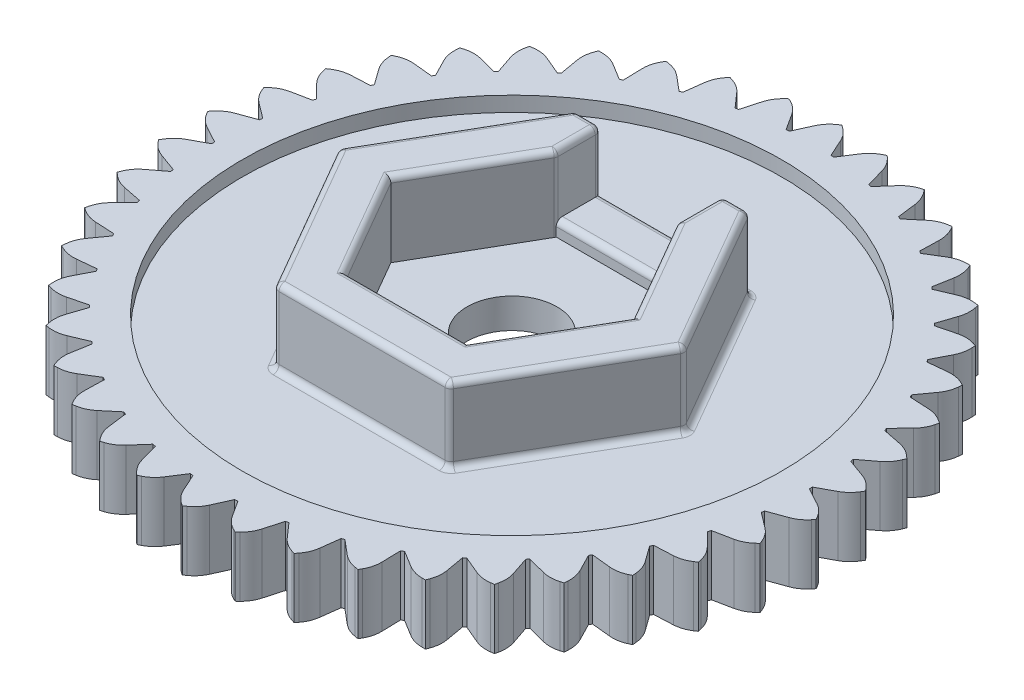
SolidWorks part; units mm, degrees
ref_plane "Front Plane" through (0, 0, 0) normal (0, 0, 1) x (1, 0, 0)
ref_plane "Top Plane" through (0, 0, 0) normal (0, 1, 0) x (1, 0, 0)
ref_plane "Right Plane" through (0, 0, 0) normal (1, 0, 0) x (0, 0, -1)
sketch "Sketch1" plane through (0, 0, 0) normal (0, 1, 0) x (1, 0, 0)
  circle A0 centre (0, 0) radius 11
  dimension "D1" = 22
extrude "Boss-Extrude1" add sketch "Sketch1" along normal blind 2
sketch "Sketch2" plane through (0, 2, 0) normal (0, 1, 0) x (1, 0, 0)
  line L0 (0, 0) -> (0, 11) construction
  line L1 (0, 0) -> (1.6395, 10.8771) construction
  line L2 (0, 0) -> (3.2423, 10.5113) construction
  line L3 (0, 0) -> (4.7727, 9.9107) construction
  line L4 (0, 0) -> (6.1965, 9.0886) construction
  line L5 (0, 0) -> (7.4819, 8.0636) construction
  line L6 (0, 0) -> (8.6001, 6.8584) construction
  line L7 (0, 0) -> (9.5263, 5.5) construction
  line L8 (0, 0) -> (10.2396, 4.0188) construction
  line L9 (0, 0) -> (10.7242, 2.4477) construction
  line L10 (0, 0) -> (10.9692, 0.822) construction
  line L11 (0, 0) -> (10.9692, -0.822) construction
  line L12 (0, 0) -> (10.7242, -2.4477) construction
  line L13 (0, 0) -> (10.2396, -4.0188) construction
  line L14 (0, 0) -> (9.5263, -5.5) construction
  line L15 (0, 0) -> (8.6001, -6.8584) construction
  line L16 (0, 0) -> (7.4819, -8.0636) construction
  line L17 (0, 0) -> (6.1965, -9.0886) construction
  line L18 (0, 0) -> (4.7727, -9.9107) construction
  line L19 (0, 0) -> (3.2423, -10.5113) construction
  line L20 (0, 0) -> (1.6395, -10.8771) construction
  line L21 (0, 0) -> (0, -11) construction
  line L22 (0, 0) -> (-1.6395, -10.8771) construction
  line L23 (0, 0) -> (-3.2423, -10.5113) construction
  line L24 (0, 0) -> (-4.7727, -9.9107) construction
  line L25 (0, 0) -> (-6.1965, -9.0886) construction
  line L26 (0, 0) -> (-7.4819, -8.0636) construction
  line L27 (0, 0) -> (-8.6001, -6.8584) construction
  line L28 (0, 0) -> (-9.5263, -5.5) construction
  line L29 (0, 0) -> (-10.2396, -4.0188) construction
  line L30 (0, 0) -> (-10.7242, -2.4477) construction
  line L31 (0, 0) -> (-10.9692, -0.822) construction
  line L32 (0, 0) -> (-10.9692, 0.822) construction
  line L33 (0, 0) -> (-10.7242, 2.4477) construction
  line L34 (0, 0) -> (-10.2396, 4.0188) construction
  line L35 (0, 0) -> (-9.5263, 5.5) construction
  line L36 (0, 0) -> (-8.6001, 6.8584) construction
  line L37 (0, 0) -> (-7.4819, 8.0636) construction
  line L38 (0, 0) -> (-6.1965, 9.0886) construction
  line L39 (0, 0) -> (-4.7727, 9.9107) construction
  line L40 (0, 0) -> (-3.2423, 10.5113) construction
  line L41 (0, 0) -> (-1.6395, 10.8771) construction
  line L42 (0, 11) -> (1.6395, 10.8771) construction
  line L43 (0.8197, 10.9386) -> (0.745, 9.9414) construction
  line L44 (0.7949, 9.9376) -> (0.6951, 9.9451)
  line L45 (0.6951, 9.9451) -> (0.4343, 10.5244)
  line L46 (0.0948, 10.9339) -> (0, 11)
  line L47 (0.7949, 9.9376) -> (1.1391, 10.4716)
  line L48 (1.5359, 10.8259) -> (1.6395, 10.8771)
  line L49 (1.7233, 10.7976) -> (1.6395, 10.8771)
  line L50 (2.1696, 9.7304) -> (1.998, 10.3421)
  line L51 (2.2671, 9.7082) -> (2.1696, 9.7304)
  line L52 (2.2671, 9.7082) -> (2.6871, 10.1848)
  line L53 (3.1322, 10.476) -> (3.2423, 10.5113)
  line L54 (3.3134, 10.4202) -> (3.2423, 10.5113)
  line L55 (3.5956, 9.2984) -> (3.5171, 9.9288)
  line L56 (3.6887, 9.2618) -> (3.5956, 9.2984)
  line L57 (3.6887, 9.2618) -> (4.1751, 9.6706)
  line L58 (4.6586, 9.8922) -> (4.7727, 9.9107)
  line L59 (4.8294, 9.8099) -> (4.7727, 9.9107)
  line L60 (4.9413, 8.6586) -> (4.9576, 9.2937)
  line L61 (5.0279, 8.6086) -> (4.9413, 8.6586)
  line L62 (5.0279, 8.6086) -> (5.5698, 8.9403)
  line L63 (6.081, 9.0874) -> (6.1965, 9.0886)
  line L64 (6.2376, 8.9806) -> (6.1965, 9.0886)
  line L65 (6.1766, 7.8254) -> (6.2874, 8.451)
  line L66 (6.2548, 7.7631) -> (6.1766, 7.8254)
  line L67 (6.2548, 7.7631) -> (6.8401, 8.0103)
  line L68 (7.3674, 8.0795) -> (7.4819, 8.0636)
  line L69 (7.5064, 7.9506) -> (7.4819, 8.0636)
  line L70 (7.274, 6.8175) -> (7.4768, 7.4195)
  line L71 (7.342, 6.7442) -> (7.274, 6.8175)
  line L72 (7.342, 6.7442) -> (7.9575, 6.9014)
  line L73 (8.4893, 6.8912) -> (8.6001, 6.8584)
  line L74 (8.6075, 6.7431) -> (8.6001, 6.8584)
  line L75 (8.2088, 5.6572) -> (8.4991, 6.2223)
  line L76 (8.2651, 5.5746) -> (8.2088, 5.6572)
  line L77 (8.2651, 5.5746) -> (8.8973, 5.6383)
  line L78 (9.4216, 5.549) -> (9.5263, 5.5)
  line L79 (9.5164, 5.3849) -> (9.5263, 5.5)
  line L80 (8.9603, 4.3705) -> (9.3315, 4.8861)
  line L81 (9.0037, 4.2804) -> (8.9603, 4.3705)
  line L82 (9.0037, 4.2804) -> (9.6382, 4.2493)
  line L83 (10.1434, 4.0828) -> (10.2396, 4.0188)
  line L84 (10.2127, 3.9064) -> (10.2396, 4.0188)
  line L85 (9.5116, 2.9863) -> (9.9556, 3.4407)
  line L86 (9.5411, 2.8907) -> (9.5116, 2.9863)
  line L87 (9.5411, 2.8907) -> (10.1639, 2.7653)
  line L88 (10.6386, 2.5254) -> (10.7242, 2.4477)
  line L89 (10.6808, 2.3406) -> (10.7242, 2.4477)
  line L90 (9.8504, 1.5353) -> (10.3572, 1.9185)
  line L91 (9.8653, 1.4364) -> (9.8504, 1.5353)
  line L92 (9.8653, 1.4364) -> (10.4625, 1.2196)
  line L93 (10.8962, 0.9116) -> (10.9692, 0.822)
  line L94 (10.9104, 0.7226) -> (10.9692, 0.822)
  line L95 (9.9692, 0.05) -> (10.5274, 0.3534)
  line L96 (9.9692, -0.05) -> (9.9692, 0.05)
  line L97 (9.9692, -0.05) -> (10.5274, -0.3534)
  line L98 (10.9104, -0.7226) -> (10.9692, -0.822)
  line L99 (10.8962, -0.9116) -> (10.9692, -0.822)
  line L100 (9.8653, -1.4364) -> (10.4625, -1.2196)
  line L101 (9.8504, -1.5353) -> (9.8653, -1.4364)
  line L102 (9.8504, -1.5353) -> (10.3572, -1.9185)
  line L103 (10.6808, -2.3406) -> (10.7242, -2.4477)
  line L104 (10.6386, -2.5254) -> (10.7242, -2.4477)
  line L105 (9.5411, -2.8907) -> (10.1639, -2.7653)
  line L106 (9.5116, -2.9863) -> (9.5411, -2.8907)
  line L107 (9.5116, -2.9863) -> (9.9556, -3.4407)
  line L108 (10.2127, -3.9064) -> (10.2396, -4.0188)
  line L109 (10.1434, -4.0828) -> (10.2396, -4.0188)
  line L110 (9.0037, -4.2804) -> (9.6382, -4.2493)
  line L111 (8.9603, -4.3705) -> (9.0037, -4.2804)
  line L112 (8.9603, -4.3705) -> (9.3315, -4.8861)
  line L113 (9.5164, -5.3849) -> (9.5263, -5.5)
  line L114 (9.4216, -5.549) -> (9.5263, -5.5)
  line L115 (8.2651, -5.5746) -> (8.8973, -5.6383)
  line L116 (8.2088, -5.6572) -> (8.2651, -5.5746)
  line L117 (8.2088, -5.6572) -> (8.4991, -6.2223)
  line L118 (8.6075, -6.7431) -> (8.6001, -6.8584)
  line L119 (8.4893, -6.8912) -> (8.6001, -6.8584)
  line L120 (7.342, -6.7442) -> (7.9575, -6.9014)
  line L121 (7.274, -6.8175) -> (7.342, -6.7442)
  line L122 (7.274, -6.8175) -> (7.4768, -7.4195)
  line L123 (7.5064, -7.9506) -> (7.4819, -8.0636)
  line L124 (7.3674, -8.0795) -> (7.4819, -8.0636)
  line L125 (6.2548, -7.7631) -> (6.8401, -8.0103)
  line L126 (6.1766, -7.8254) -> (6.2548, -7.7631)
  line L127 (6.1766, -7.8254) -> (6.2874, -8.451)
  line L128 (6.2376, -8.9806) -> (6.1965, -9.0886)
  line L129 (6.081, -9.0874) -> (6.1965, -9.0886)
  line L130 (5.0279, -8.6086) -> (5.5698, -8.9403)
  line L131 (4.9413, -8.6586) -> (5.0279, -8.6086)
  line L132 (4.9413, -8.6586) -> (4.9576, -9.2937)
  line L133 (4.8294, -9.8099) -> (4.7727, -9.9107)
  line L134 (4.6586, -9.8922) -> (4.7727, -9.9107)
  line L135 (3.6887, -9.2618) -> (4.1751, -9.6706)
  line L136 (3.5956, -9.2984) -> (3.6887, -9.2618)
  line L137 (3.5956, -9.2984) -> (3.5171, -9.9288)
  line L138 (3.3134, -10.4202) -> (3.2423, -10.5113)
  line L139 (3.1322, -10.476) -> (3.2423, -10.5113)
  line L140 (2.2671, -9.7082) -> (2.6871, -10.1848)
  line L141 (2.1696, -9.7304) -> (2.2671, -9.7082)
  line L142 (2.1696, -9.7304) -> (1.998, -10.3421)
  line L143 (1.7233, -10.7976) -> (1.6395, -10.8771)
  line L144 (1.5359, -10.8259) -> (1.6395, -10.8771)
  line L145 (0.7949, -9.9376) -> (1.1391, -10.4716)
  line L146 (0.6951, -9.9451) -> (0.7949, -9.9376)
  line L147 (0.6951, -9.9451) -> (0.4343, -10.5244)
  line L148 (0.0948, -10.9339) -> (0, -11)
  line L149 (-0.0948, -10.9339) -> (0, -11)
  line L150 (-0.6951, -9.9451) -> (-0.4343, -10.5244)
  line L151 (-0.7949, -9.9376) -> (-0.6951, -9.9451)
  line L152 (-0.7949, -9.9376) -> (-1.1391, -10.4716)
  line L153 (-1.5359, -10.8259) -> (-1.6395, -10.8771)
  line L154 (-1.7233, -10.7976) -> (-1.6395, -10.8771)
  line L155 (-2.1696, -9.7304) -> (-1.998, -10.3421)
  line L156 (-2.2671, -9.7082) -> (-2.1696, -9.7304)
  line L157 (-2.2671, -9.7082) -> (-2.6871, -10.1848)
  line L158 (-3.1322, -10.476) -> (-3.2423, -10.5113)
  line L159 (-3.3134, -10.4202) -> (-3.2423, -10.5113)
  line L160 (-3.5956, -9.2984) -> (-3.5171, -9.9288)
  line L161 (-3.6887, -9.2618) -> (-3.5956, -9.2984)
  line L162 (-3.6887, -9.2618) -> (-4.1751, -9.6706)
  line L163 (-4.6586, -9.8922) -> (-4.7727, -9.9107)
  line L164 (-4.8294, -9.8099) -> (-4.7727, -9.9107)
  line L165 (-4.9413, -8.6586) -> (-4.9576, -9.2937)
  line L166 (-5.0279, -8.6086) -> (-4.9413, -8.6586)
  line L167 (-5.0279, -8.6086) -> (-5.5698, -8.9403)
  line L168 (-6.081, -9.0874) -> (-6.1965, -9.0886)
  line L169 (-6.2376, -8.9806) -> (-6.1965, -9.0886)
  line L170 (-6.1766, -7.8254) -> (-6.2874, -8.451)
  line L171 (-6.2548, -7.7631) -> (-6.1766, -7.8254)
  line L172 (-6.2548, -7.7631) -> (-6.8401, -8.0103)
  line L173 (-7.3674, -8.0795) -> (-7.4819, -8.0636)
  line L174 (-7.5064, -7.9506) -> (-7.4819, -8.0636)
  line L175 (-7.274, -6.8175) -> (-7.4768, -7.4195)
  line L176 (-7.342, -6.7442) -> (-7.274, -6.8175)
  line L177 (-7.342, -6.7442) -> (-7.9575, -6.9014)
  line L178 (-8.4893, -6.8912) -> (-8.6001, -6.8584)
  line L179 (-8.6075, -6.7431) -> (-8.6001, -6.8584)
  line L180 (-8.2088, -5.6572) -> (-8.4991, -6.2223)
  line L181 (-8.2651, -5.5746) -> (-8.2088, -5.6572)
  line L182 (-8.2651, -5.5746) -> (-8.8973, -5.6383)
  line L183 (-9.4216, -5.549) -> (-9.5263, -5.5)
  line L184 (-9.5164, -5.3849) -> (-9.5263, -5.5)
  line L185 (-8.9603, -4.3705) -> (-9.3315, -4.8861)
  line L186 (-9.0037, -4.2804) -> (-8.9603, -4.3705)
  line L187 (-9.0037, -4.2804) -> (-9.6382, -4.2493)
  line L188 (-10.1434, -4.0828) -> (-10.2396, -4.0188)
  line L189 (-10.2127, -3.9064) -> (-10.2396, -4.0188)
  line L190 (-9.5116, -2.9863) -> (-9.9556, -3.4407)
  line L191 (-9.5411, -2.8907) -> (-9.5116, -2.9863)
  line L192 (-9.5411, -2.8907) -> (-10.1639, -2.7653)
  line L193 (-10.6386, -2.5254) -> (-10.7242, -2.4477)
  line L194 (-10.6808, -2.3406) -> (-10.7242, -2.4477)
  line L195 (-9.8504, -1.5353) -> (-10.3572, -1.9185)
  line L196 (-9.8653, -1.4364) -> (-9.8504, -1.5353)
  line L197 (-9.8653, -1.4364) -> (-10.4625, -1.2196)
  line L198 (-10.8962, -0.9116) -> (-10.9692, -0.822)
  line L199 (-10.9104, -0.7226) -> (-10.9692, -0.822)
  line L200 (-9.9692, -0.05) -> (-10.5274, -0.3534)
  line L201 (-9.9692, 0.05) -> (-9.9692, -0.05)
  line L202 (-9.9692, 0.05) -> (-10.5274, 0.3534)
  line L203 (-10.9104, 0.7226) -> (-10.9692, 0.822)
  line L204 (-10.8962, 0.9116) -> (-10.9692, 0.822)
  line L205 (-9.8653, 1.4364) -> (-10.4625, 1.2196)
  line L206 (-9.8504, 1.5353) -> (-9.8653, 1.4364)
  line L207 (-9.8504, 1.5353) -> (-10.3572, 1.9185)
  line L208 (-10.6808, 2.3406) -> (-10.7242, 2.4477)
  line L209 (-10.6386, 2.5254) -> (-10.7242, 2.4477)
  line L210 (-9.5411, 2.8907) -> (-10.1639, 2.7653)
  line L211 (-9.5116, 2.9863) -> (-9.5411, 2.8907)
  line L212 (-9.5116, 2.9863) -> (-9.9556, 3.4407)
  line L213 (-10.2127, 3.9064) -> (-10.2396, 4.0188)
  line L214 (-10.1434, 4.0828) -> (-10.2396, 4.0188)
  line L215 (-9.0037, 4.2804) -> (-9.6382, 4.2493)
  line L216 (-8.9603, 4.3705) -> (-9.0037, 4.2804)
  line L217 (-8.9603, 4.3705) -> (-9.3315, 4.8861)
  line L218 (-9.5164, 5.3849) -> (-9.5263, 5.5)
  line L219 (-9.4216, 5.549) -> (-9.5263, 5.5)
  line L220 (-8.2651, 5.5746) -> (-8.8973, 5.6383)
  line L221 (-8.2088, 5.6572) -> (-8.2651, 5.5746)
  line L222 (-8.2088, 5.6572) -> (-8.4991, 6.2223)
  line L223 (-8.6075, 6.7431) -> (-8.6001, 6.8584)
  line L224 (-8.4893, 6.8912) -> (-8.6001, 6.8584)
  line L225 (-7.342, 6.7442) -> (-7.9575, 6.9014)
  line L226 (-7.274, 6.8175) -> (-7.342, 6.7442)
  line L227 (-7.274, 6.8175) -> (-7.4768, 7.4195)
  line L228 (-7.5064, 7.9506) -> (-7.4819, 8.0636)
  line L229 (-7.3674, 8.0795) -> (-7.4819, 8.0636)
  line L230 (-6.2548, 7.7631) -> (-6.8401, 8.0103)
  line L231 (-6.1766, 7.8254) -> (-6.2548, 7.7631)
  line L232 (-6.1766, 7.8254) -> (-6.2874, 8.451)
  line L233 (-6.2376, 8.9806) -> (-6.1965, 9.0886)
  line L234 (-6.081, 9.0874) -> (-6.1965, 9.0886)
  line L235 (-5.0279, 8.6086) -> (-5.5698, 8.9403)
  line L236 (-4.9413, 8.6586) -> (-5.0279, 8.6086)
  line L237 (-4.9413, 8.6586) -> (-4.9576, 9.2937)
  line L238 (-4.8294, 9.8099) -> (-4.7727, 9.9107)
  line L239 (-4.6586, 9.8922) -> (-4.7727, 9.9107)
  line L240 (-3.6887, 9.2618) -> (-4.1751, 9.6706)
  line L241 (-3.5956, 9.2984) -> (-3.6887, 9.2618)
  line L242 (-3.5956, 9.2984) -> (-3.5171, 9.9288)
  line L243 (-3.3134, 10.4202) -> (-3.2423, 10.5113)
  line L244 (-3.1322, 10.476) -> (-3.2423, 10.5113)
  line L245 (-2.2671, 9.7082) -> (-2.6871, 10.1848)
  line L246 (-2.1696, 9.7304) -> (-2.2671, 9.7082)
  line L247 (-2.1696, 9.7304) -> (-1.998, 10.3421)
  line L248 (-1.7233, 10.7976) -> (-1.6395, 10.8771)
  line L249 (-1.5359, 10.8259) -> (-1.6395, 10.8771)
  line L250 (-0.7949, 9.9376) -> (-1.1391, 10.4716)
  line L251 (-0.6951, 9.9451) -> (-0.7949, 9.9376)
  line L252 (-0.6951, 9.9451) -> (-0.4343, 10.5244)
  line L253 (-0.0948, 10.9339) -> (0, 11)
  circle A0 centre (0, 0) radius 11 construction
  arc A1 (0.4343, 10.5244) -> (0.0948, 10.9339) centre (-0.4775, 10.1138) ccw
  arc A2 (1.1391, 10.4716) -> (1.5359, 10.8259) centre (1.9796, 9.9297) cw
  arc A3 (1.998, 10.3421) -> (1.7233, 10.7976) centre (1.0352, 10.072) ccw
  arc A4 (2.6871, 10.1848) -> (3.1322, 10.476) centre (3.4374, 9.5237) cw
  arc A5 (3.5171, 9.9288) -> (3.3134, 10.4202) centre (2.5248, 9.8052) ccw
  arc A6 (4.1751, 9.6706) -> (4.6586, 9.8922) centre (4.8185, 8.905) cw
  arc A7 (4.9576, 9.2937) -> (4.8294, 9.8099) centre (3.958, 9.3194) ccw
  arc A8 (5.5698, 8.9403) -> (6.081, 9.0874) centre (6.0919, 8.0874) cw
  arc A9 (6.2874, 8.451) -> (6.2376, 8.9806) centre (5.3028, 8.6254) ccw
  arc A10 (6.8401, 8.0103) -> (7.3674, 8.0795) centre (7.2292, 7.0891) cw
  arc A11 (7.4768, 7.4195) -> (7.5064, 7.9506) centre (6.5291, 7.7388) ccw
  arc A12 (7.9575, 6.9014) -> (8.4893, 6.8912) centre (8.205, 5.9325) cw
  arc A13 (8.4991, 6.2223) -> (8.6075, 6.7431) centre (7.6096, 6.6792) ccw
  arc A14 (8.8973, 5.6383) -> (9.4216, 5.549) centre (8.9976, 4.6434) cw
  arc A15 (9.3315, 4.8861) -> (9.5164, 5.3849) centre (8.5201, 5.4705) ccw
  arc A16 (9.6382, 4.2493) -> (10.1434, 4.0828) centre (9.5892, 3.2505) cw
  arc A17 (9.9556, 3.4407) -> (10.2127, 3.9064) centre (9.2402, 4.1395) ccw
  arc A18 (10.1639, 2.7653) -> (10.6386, 2.5254) centre (9.9665, 1.785) cw
  arc A19 (10.3572, 1.9185) -> (10.6808, 2.3406) centre (9.754, 2.7161) ccw
  arc A20 (10.4625, 1.2196) -> (10.8962, 0.9116) centre (10.1212, 0.2796) cw
  arc A21 (10.5274, 0.3534) -> (10.9104, 0.7226) centre (10.0499, 1.232) ccw
  arc A22 (10.5274, -0.3534) -> (10.9104, -0.7226) centre (10.0499, -1.232) cw
  arc A23 (10.4625, -1.2196) -> (10.8962, -0.9116) centre (10.1212, -0.2796) ccw
  arc A24 (10.3572, -1.9185) -> (10.6808, -2.3406) centre (9.754, -2.7161) cw
  arc A25 (10.1639, -2.7653) -> (10.6386, -2.5254) centre (9.9665, -1.785) ccw
  arc A26 (9.9556, -3.4407) -> (10.2127, -3.9064) centre (9.2402, -4.1395) cw
  arc A27 (9.6382, -4.2493) -> (10.1434, -4.0828) centre (9.5892, -3.2505) ccw
  arc A28 (9.3315, -4.8861) -> (9.5164, -5.3849) centre (8.5201, -5.4705) cw
  arc A29 (8.8973, -5.6383) -> (9.4216, -5.549) centre (8.9976, -4.6434) ccw
  arc A30 (8.4991, -6.2223) -> (8.6075, -6.7431) centre (7.6096, -6.6792) cw
  arc A31 (7.9575, -6.9014) -> (8.4893, -6.8912) centre (8.205, -5.9325) ccw
  arc A32 (7.4768, -7.4195) -> (7.5064, -7.9506) centre (6.5291, -7.7388) cw
  arc A33 (6.8401, -8.0103) -> (7.3674, -8.0795) centre (7.2292, -7.0891) ccw
  arc A34 (6.2874, -8.451) -> (6.2376, -8.9806) centre (5.3028, -8.6254) cw
  arc A35 (5.5698, -8.9403) -> (6.081, -9.0874) centre (6.0919, -8.0874) ccw
  arc A36 (4.9576, -9.2937) -> (4.8294, -9.8099) centre (3.958, -9.3194) cw
  arc A37 (4.1751, -9.6706) -> (4.6586, -9.8922) centre (4.8185, -8.905) ccw
  arc A38 (3.5171, -9.9288) -> (3.3134, -10.4202) centre (2.5248, -9.8052) cw
  arc A39 (2.6871, -10.1848) -> (3.1322, -10.476) centre (3.4374, -9.5237) ccw
  arc A40 (1.998, -10.3421) -> (1.7233, -10.7976) centre (1.0352, -10.072) cw
  arc A41 (1.1391, -10.4716) -> (1.5359, -10.8259) centre (1.9796, -9.9297) ccw
  arc A42 (0.4343, -10.5244) -> (0.0948, -10.9339) centre (-0.4775, -10.1138) cw
  arc A43 (-0.4343, -10.5244) -> (-0.0948, -10.9339) centre (0.4775, -10.1138) ccw
  arc A44 (-1.1391, -10.4716) -> (-1.5359, -10.8259) centre (-1.9796, -9.9297) cw
  arc A45 (-1.998, -10.3421) -> (-1.7233, -10.7976) centre (-1.0352, -10.072) ccw
  arc A46 (-2.6871, -10.1848) -> (-3.1322, -10.476) centre (-3.4374, -9.5237) cw
  arc A47 (-3.5171, -9.9288) -> (-3.3134, -10.4202) centre (-2.5248, -9.8052) ccw
  arc A48 (-4.1751, -9.6706) -> (-4.6586, -9.8922) centre (-4.8185, -8.905) cw
  arc A49 (-4.9576, -9.2937) -> (-4.8294, -9.8099) centre (-3.958, -9.3194) ccw
  arc A50 (-5.5698, -8.9403) -> (-6.081, -9.0874) centre (-6.0919, -8.0874) cw
  arc A51 (-6.2874, -8.451) -> (-6.2376, -8.9806) centre (-5.3028, -8.6254) ccw
  arc A52 (-6.8401, -8.0103) -> (-7.3674, -8.0795) centre (-7.2292, -7.0891) cw
  arc A53 (-7.4768, -7.4195) -> (-7.5064, -7.9506) centre (-6.5291, -7.7388) ccw
  arc A54 (-7.9575, -6.9014) -> (-8.4893, -6.8912) centre (-8.205, -5.9325) cw
  arc A55 (-8.4991, -6.2223) -> (-8.6075, -6.7431) centre (-7.6096, -6.6792) ccw
  arc A56 (-8.8973, -5.6383) -> (-9.4216, -5.549) centre (-8.9976, -4.6434) cw
  arc A57 (-9.3315, -4.8861) -> (-9.5164, -5.3849) centre (-8.5201, -5.4705) ccw
  arc A58 (-9.6382, -4.2493) -> (-10.1434, -4.0828) centre (-9.5892, -3.2505) cw
  arc A59 (-9.9556, -3.4407) -> (-10.2127, -3.9064) centre (-9.2402, -4.1395) ccw
  arc A60 (-10.1639, -2.7653) -> (-10.6386, -2.5254) centre (-9.9665, -1.785) cw
  arc A61 (-10.3572, -1.9185) -> (-10.6808, -2.3406) centre (-9.754, -2.7161) ccw
  arc A62 (-10.4625, -1.2196) -> (-10.8962, -0.9116) centre (-10.1212, -0.2796) cw
  arc A63 (-10.5274, -0.3534) -> (-10.9104, -0.7226) centre (-10.0499, -1.232) ccw
  arc A64 (-10.5274, 0.3534) -> (-10.9104, 0.7226) centre (-10.0499, 1.232) cw
  arc A65 (-10.4625, 1.2196) -> (-10.8962, 0.9116) centre (-10.1212, 0.2796) ccw
  arc A66 (-10.3572, 1.9185) -> (-10.6808, 2.3406) centre (-9.754, 2.7161) cw
  arc A67 (-10.1639, 2.7653) -> (-10.6386, 2.5254) centre (-9.9665, 1.785) ccw
  arc A68 (-9.9556, 3.4407) -> (-10.2127, 3.9064) centre (-9.2402, 4.1395) cw
  arc A69 (-9.6382, 4.2493) -> (-10.1434, 4.0828) centre (-9.5892, 3.2505) ccw
  arc A70 (-9.3315, 4.8861) -> (-9.5164, 5.3849) centre (-8.5201, 5.4705) cw
  arc A71 (-8.8973, 5.6383) -> (-9.4216, 5.549) centre (-8.9976, 4.6434) ccw
  arc A72 (-8.4991, 6.2223) -> (-8.6075, 6.7431) centre (-7.6096, 6.6792) cw
  arc A73 (-7.9575, 6.9014) -> (-8.4893, 6.8912) centre (-8.205, 5.9325) ccw
  arc A74 (-7.4768, 7.4195) -> (-7.5064, 7.9506) centre (-6.5291, 7.7388) cw
  arc A75 (-6.8401, 8.0103) -> (-7.3674, 8.0795) centre (-7.2292, 7.0891) ccw
  arc A76 (-6.2874, 8.451) -> (-6.2376, 8.9806) centre (-5.3028, 8.6254) cw
  arc A77 (-5.5698, 8.9403) -> (-6.081, 9.0874) centre (-6.0919, 8.0874) ccw
  arc A78 (-4.9576, 9.2937) -> (-4.8294, 9.8099) centre (-3.958, 9.3194) cw
  arc A79 (-4.1751, 9.6706) -> (-4.6586, 9.8922) centre (-4.8185, 8.905) ccw
  arc A80 (-3.5171, 9.9288) -> (-3.3134, 10.4202) centre (-2.5248, 9.8052) cw
  arc A81 (-2.6871, 10.1848) -> (-3.1322, 10.476) centre (-3.4374, 9.5237) ccw
  arc A82 (-1.998, 10.3421) -> (-1.7233, 10.7976) centre (-1.0352, 10.072) cw
  arc A83 (-1.1391, 10.4716) -> (-1.5359, 10.8259) centre (-1.9796, 9.9297) ccw
  arc A84 (-0.4343, 10.5244) -> (-0.0948, 10.9339) centre (0.4775, 10.1138) cw
  dimension "D4" = 1
  dimension "D2" = 1
  dimension "D3" = 0.05
  dimension "D1" = 42
  dimension "D5" = 42
extrude "Cut-Extrude1" cut sketch "Sketch2" against normal blind 2 flip side to cut
sketch "Sketch3" plane through (0, 2, 0) normal (0, 1, 0) x (1, 0, 0)
  circle A0 centre (0, 0) radius 9
  dimension "D1" = 18
extrude "Cut-Extrude2" cut sketch "Sketch3" against normal blind 0.5
sketch "Sketch4" plane through (0, 0, 0) normal (0, -1, 0) x (1, 0, 0)
  circle A0 centre (0, 0) radius 9
extrude "Cut-Extrude3" cut sketch "Sketch4" against normal blind 0.5
sketch "Sketch8" plane through (0, 1.5, 0) normal (0, 1, 0) x (1, 0, 0)
  line L0 (-2.0207, 3.5) -> (-4.0415, 0)
  line L1 (5.7735, 0) -> (2.8868, 5)
  line L2 (2.8868, 5) -> (-2.8868, 5)
  line L3 (-2.8868, 5) -> (-5.7735, 0)
  line L4 (-5.7735, 0) -> (-2.8868, -5)
  line L5 (-2.8868, -5) -> (2.8868, -5)
  line L6 (2.8868, -5) -> (5.7735, 0)
  line L7 (-4.0415, 0) -> (-2.0207, -3.5)
  line L8 (-2.0207, -3.5) -> (2.0207, -3.5)
  line L9 (2.0207, -3.5) -> (4.0415, 0)
  line L10 (4.0415, 0) -> (2.0207, 3.5)
  line L11 (2.0207, 3.5) -> (-2.0207, 3.5)
  circle A0 centre (0, 0) radius 5 construction
  dimension "D1" = 10
  dimension "D2" = 1.5
extrude "Boss-Extrude4" add sketch "Sketch8" along normal blind 2.5
sketch "Sketch9" plane through (0, 4, 0) normal (0, 1, 0) x (1, 0, 0)
  line L0 (2.8868, 5) -> (-2.8868, 5) construction
  line L1 (2.0207, 3.5) -> (-2.0207, 3.5)
  line L2 (2.0207, 3.5) -> (2.0207, 5)
  line L3 (2.0207, 5) -> (-2.0207, 5)
  line L4 (-2.0207, 3.5) -> (-2.0207, 5)
  dimension "D1" = 0
extrude "Cut-Extrude5" cut sketch "Sketch9" against normal blind 2
fillet "Fillet2" radius 0.2 26 edges at (-2.8868, 2.75, -5) (-5.7735, 2.75, 0) (-2.8868, 2.75, 5) (2.8868, 2.75, -5) (5.7735, 2.75, 0) (2.8868, 2.75, 5) (-2.0207, 3, -5) (2.0207, 3, -5) (2.0207, 3, -3.5) (-2.0207, 3, -3.5) (0, 2, -5) (0, 2, -3.5) (-2.4537, 4, -5) (-2.0207, 4, -4.25) (-3.0311, 4, -1.75) (-3.0311, 4, 1.75) (0, 4, 3.5) (3.0311, 4, 1.75) (3.0311, 4, -1.75) (2.0207, 4, -4.25) (2.4537, 4, -5) (4.3301, 4, -2.5) (4.3301, 4, 2.5) (0, 4, 5) (-4.3301, 4, 2.5) (-4.3301, 4, -2.5)
sketch "Sketch10" plane through (0, 1.5, 0) normal (0, 1, 0) x (1, 0, 0)
  circle A0 centre (0, 0) radius 1.5
  dimension "D1" = 3
extrude "Cut-Extrude6" cut sketch "Sketch10" against normal through all
fillet "Fillet3" radius 0.2 12 edges at (2.8713, 1.5, 4.9732) (0, 1.5, 5) (-2.8713, 1.5, 4.9732) (-4.3301, 1.5, 2.5) (-5.7426, 1.5, 0) (-4.3301, 1.5, -2.5) (-2.8713, 1.5, -4.9732) (0, 1.5, -5) (2.8713, 1.5, -4.9732) (4.3301, 1.5, -2.5) (5.7426, 1.5, 0) (4.3301, 1.5, 2.5)
